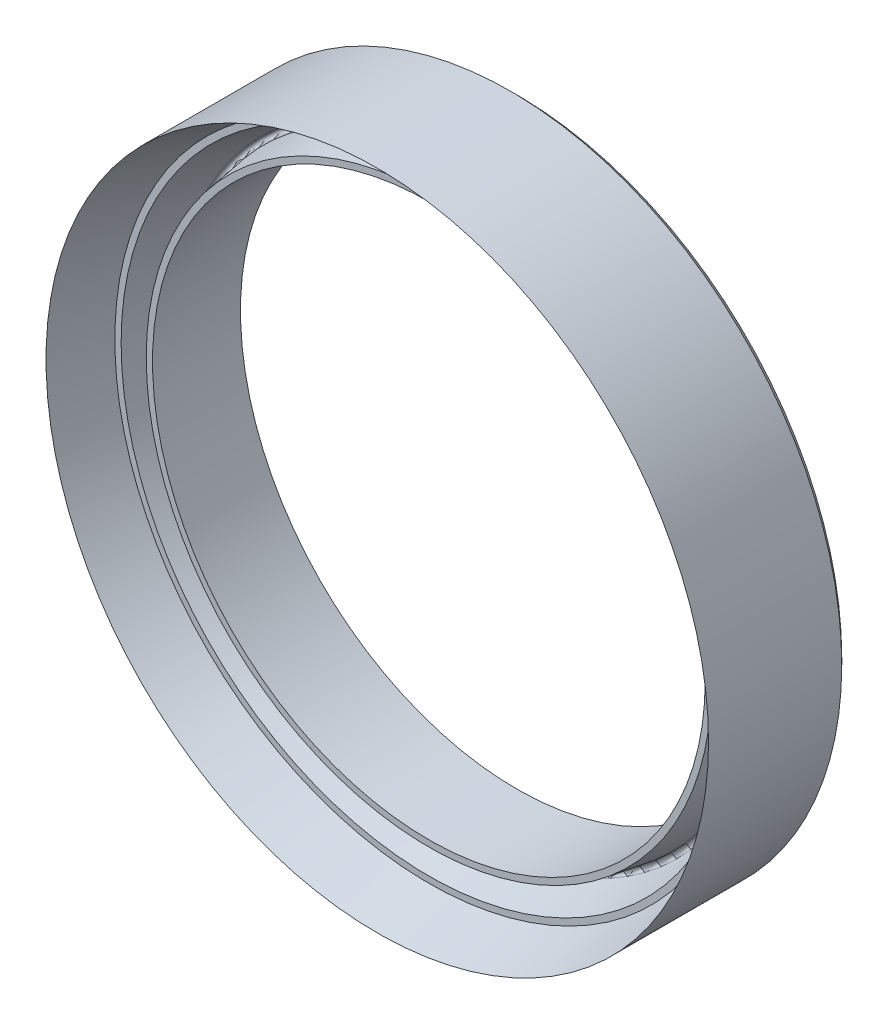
SolidWorks part; units mm, degrees
ref_plane "Plan1" through (0, 0, 0) normal (0, 0, 1) x (1, 0, 0)
ref_plane "Plan2" through (0, 0, 0) normal (0, 1, 0) x (1, 0, 0)
ref_plane "Plan3" through (0, 0, 0) normal (1, 0, 0) x (0, 0, -1)
sketch "Esquisse1" plane through (0, 0, 0) normal (1, 0, 0) x (0, 0, -1)
  line L0 (-20, 0) -> (60, 0) construction
  line L2 (0, 22) -> (0, 22.5)
  line L3 (0, 22.5) -> (3.0795, 22.9756)
  line L4 (3.1203, 23.4599) -> (0, 24.5)
  line L5 (0, 24.5) -> (0, 25)
  line L6 (0, 25) -> (-4.1063, 26.3688)
  line L7 (-4.1063, 26.3688) -> (7, 26.3688)
  line L8 (0, 22) -> (7, 22)
  line L9 (7, 26.3688) -> (7, 22)
  arc A0 (3.0795, 22.9756) -> (3.1203, 23.4599) centre (3.0413, 23.2227) ccw
  dimension "D1" = 0.25
  dimension "D6" = 3.0413
  dimension "D2" = 7
  dimension "D3" = 22
  dimension "D4" = 4.3688
  dimension "D5" = 0.4743
  dimension "D7" = 3.116
revolve "Base-Révolution" add sketch "Esquisse1" angle 360 about L0
chamfer "Chanfrein1" distance 0.5 angle 45
